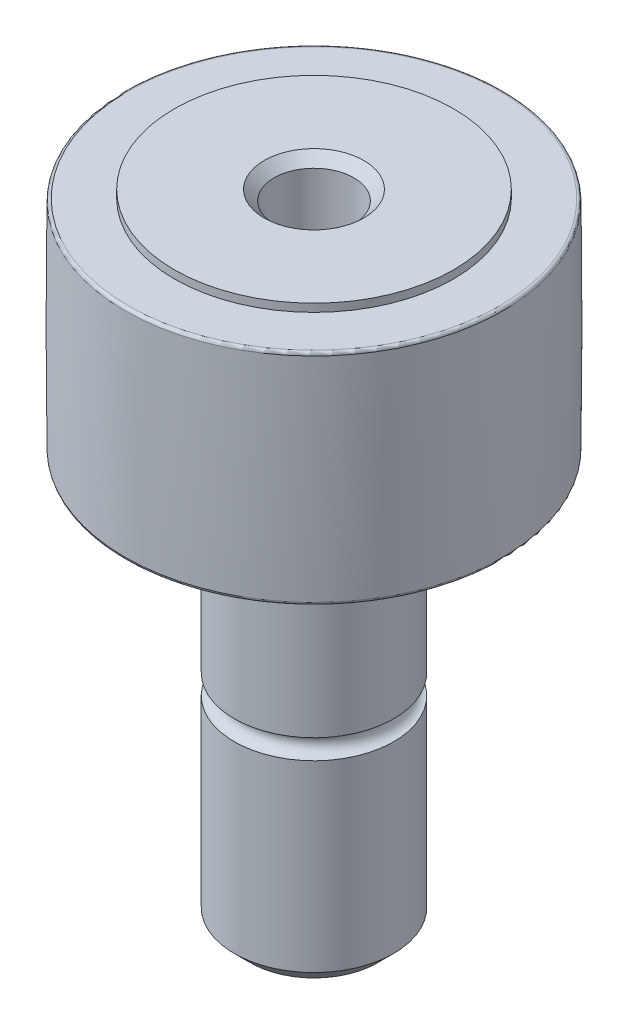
SolidWorks part; units mm, degrees
ref_plane "Plan1" through (0, 0, 0) normal (0, 0, 1) x (1, 0, 0)
ref_plane "Plan2" through (0, 0, 0) normal (0, 1, 0) x (1, 0, 0)
ref_plane "Plan3" through (0, 0, 0) normal (1, 0, 0) x (0, 0, -1)
sketch "Esquisse1" plane through (0, 0, 0) normal (0, 0, 1) x (1, 0, 0)
  line L0 (0, -6.8903) -> (0, 44.0974) construction
  line L1 (0, 0) -> (4, 0)
  line L2 (4, 0) -> (4, 10)
  line L3 (4, 20) -> (7, 20)
  line L4 (7, 20) -> (7, 20.6)
  line L5 (7, 20.6) -> (9.4697, 20.6)
  line L6 (4, 11) -> (4, 20)
  line L7 (9.4697, 31.6) -> (7, 31.6)
  line L8 (7, 31.6) -> (7, 32)
  line L9 (7, 32) -> (0, 32)
  line L10 (0, 32) -> (0, 0)
  arc A0 (9.4697, 31.6) -> (9.4697, 20.6) centre (-490.5, 26.1) cw
  arc A1 (4, 11) -> (4, 10) centre (4, 10.5) ccw
  dimension "D5" = 500
  dimension "D9" = 9.5
  dimension "D11" = 0.5
  dimension "D1" = 11
  dimension "D2" = 20
  dimension "D3" = 4
  dimension "D4" = 7
  dimension "D6" = 0.6
  dimension "D7" = 32
  dimension "D8" = 5.5
  dimension "D10" = 10
revolve "Base-Révolution" add sketch "Esquisse1" angle 360 about L0
chamfer "Chanfrein1" distance 0.8 angle 45 1 edges at (0, 0, -4)
hole_wizard "Perçage1" positions "Esquisse3" profile "Esquisse2" legacy
sketch "Esquisse3" plane through (0, 32, 0) normal (0, 1, 0) x (-1, 0, 0)
  point P0 (0, 0)
sketch "Esquisse2" plane through (0, 32, 0) normal (1, 0, 0) x (0, 0, 1)
  line L0 (0, 0) -> (0, 10.866)
  line L1 (0, 10.866) -> (1.5, 10)
  line L2 (1.5, 10) -> (1.5, 0)
  line L4 (1.5, 0) -> (0, 0)
  line L6 (0, 10.866) -> (-1.5, 10) construction
  line L7 (0, -4.2442) -> (0, 117.3081) construction
  dimension "Diamètre" = 3
  dimension "Profondeur" = 10
  dimension "Angle" = 120
hole_wizard "Perçage2" positions "Esquisse5" profile "Esquisse4" legacy
sketch "Esquisse5" plane through (0, 32, 0) normal (0, 1, 0) x (-1, 0, 0)
  point P0 (0, 0)
sketch "Esquisse4" plane through (0, 32, 0) normal (1, 0, 0) x (0, 0, 1)
  line L0 (0, 0) -> (0, 7.1547)
  line L1 (0, 7.1547) -> (2, 6)
  line L2 (2, 6) -> (2, 0)
  line L4 (2, 0) -> (0, 0)
  line L6 (0, 7.1547) -> (-2, 6) construction
  line L7 (0, -4.2442) -> (0, 117.3081) construction
  dimension "Diamètre" = 4
  dimension "Profondeur" = 6
  dimension "Angle" = 120
fillet "Congé1" radius 0.15 2 edges at (0, 20.6, -9.4697) (0, 31.6, -9.4697)
chamfer "Chanfrein2" distance 0.5 angle 45 1 edges at (0, 32, 2)
